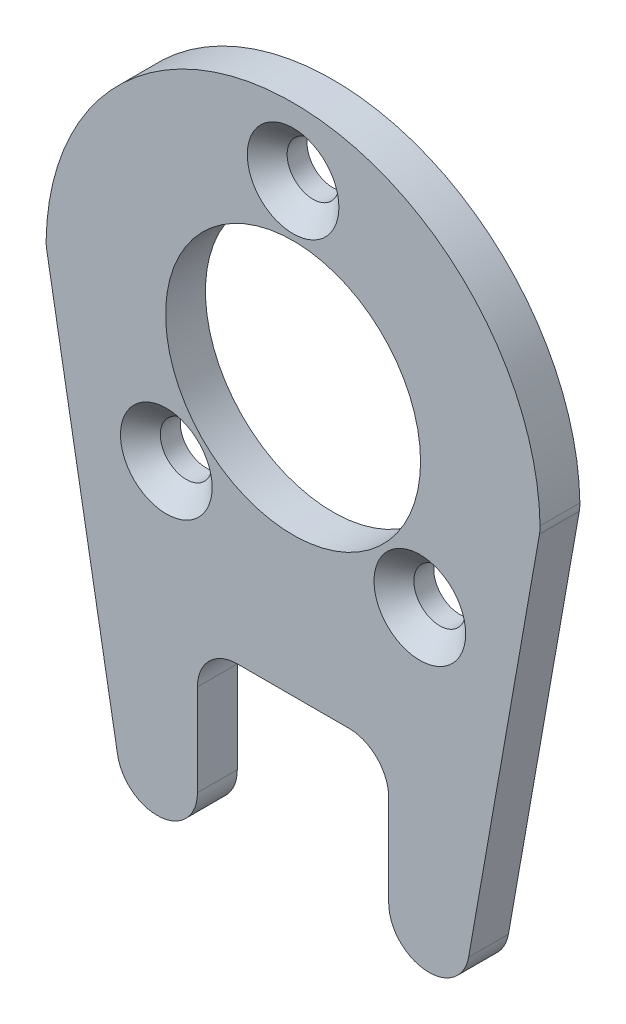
SolidWorks part; units mm, degrees
ref_plane "Plan de face" through (0, 0, 0) normal (0, 0, 1) x (1, 0, 0)
ref_plane "Plan de dessus" through (0, 0, 0) normal (0, 1, 0) x (1, 0, 0)
ref_plane "Plan de droite" through (0, 0, 0) normal (1, 0, 0) x (0, 0, -1)
sketch "Esquisse1" plane through (0, 0, 0) normal (0, 0, 1) x (1, 0, 0)
  line L0 (-22.3045, -50.4184) -> (-31.1947, 0)
  line L1 (-12.274, -38.0501) -> (-12.274, -49.5501)
  line L2 (6.726, -33.0501) -> (-7.274, -33.0501)
  line L3 (11.726, -49.5501) -> (11.726, -38.0501)
  line L4 (30.6467, 0) -> (21.7566, -50.4184)
  line L5 (-17.3805, -54.5501) -> (-17.274, -54.5501)
  line L6 (16.726, -54.5501) -> (16.8325, -54.5501)
  arc A0 (30.722, 0.9487) -> (-31.27, 0.9487) centre (-0.274, 0.4499) ccw
  arc A1 (-31.27, 0.9487) -> (-31.1947, 0) centre (-26.2706, 0.8682) ccw
  arc A2 (-22.3045, -50.4184) -> (-17.3805, -54.5501) centre (-17.3805, -49.5501) ccw
  arc A3 (-17.274, -54.5501) -> (-12.274, -49.5501) centre (-17.274, -49.5501) ccw
  arc A4 (-7.274, -33.0501) -> (-12.274, -38.0501) centre (-7.274, -38.0501) ccw
  arc A5 (11.726, -38.0501) -> (6.726, -33.0501) centre (6.726, -38.0501) ccw
  arc A6 (11.726, -49.5501) -> (16.726, -54.5501) centre (16.726, -49.5501) ccw
  arc A7 (16.8325, -54.5501) -> (21.7566, -50.4184) centre (16.8325, -49.5501) ccw
  arc A8 (30.6467, 0) -> (30.722, 0.9487) centre (25.7226, 0.8682) ccw
  circle A9 centre (-0.274, 0.4499) radius 16
  circle A10 centre (-0.274, 22.9499) radius 3.25
  circle A11 centre (-16.1839, -15.46) radius 3.25
  circle A12 centre (15.6359, -15.46) radius 3.25
extrude "Extrusion1" add sketch "Esquisse1" along normal blind 5
ref_plane "Plan1" through (0, 0, 2) normal (0, 0, -1) x (-1, 0, 0)
chamfer "Chanfrein1" distance 2.5 angle 45 3 edges at (18.8859, -15.46, 5) (-12.9339, -15.46, 5) (2.976, 22.9499, 5)
